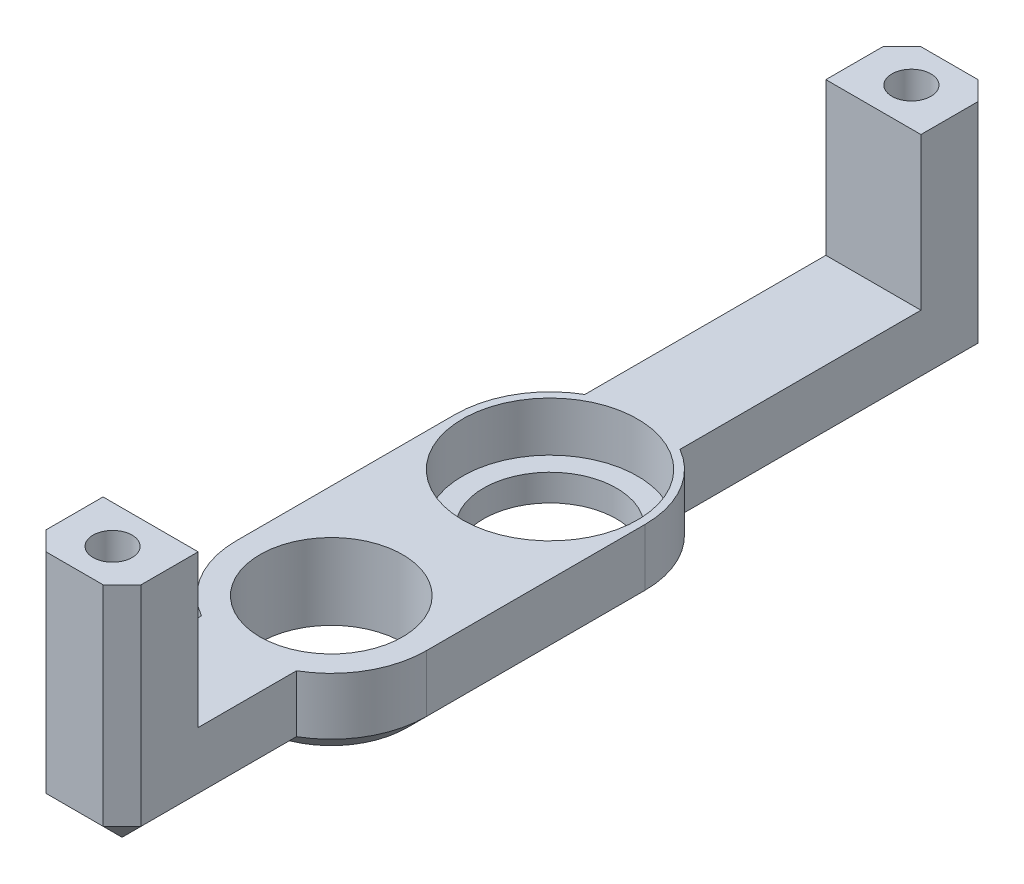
SolidWorks part; units mm, degrees
ref_plane "Plano frontal" through (0, 0, 0) normal (0, 0, 1) x (1, 0, 0)
ref_plane "Plano superior" through (0, 0, 0) normal (0, 1, 0) x (1, 0, 0)
ref_plane "Plano direito" through (0, 0, 0) normal (1, 0, 0) x (0, 0, -1)
sketch "Esboço2" plane through (0, 0, 0) normal (0, 1, 0) x (1, 0, 0)
  line L0 (0, 0) -> (0, 46)
  line L1 (0, 46) -> (10, 46)
  line L2 (10, 46) -> (10, 0)
  line L3 (10, 0) -> (0, 0)
  dimension "D1" = 46
  dimension "D2" = 10
extrude "Ressalto-extrusão1" add sketch "Esboço2" along normal blind 4
sketch "Esboço3" plane through (0, 4, 0) normal (0, 1, 0) x (1, 0, 0)
  line L0 (5, 46) -> (5, 25) construction
  line L1 (10, 46) -> (0, 46) construction
  line L2 (5, 25) -> (5, 13.5) construction
  circle A0 centre (5, 25) radius 4.6
  dimension "D3" = 9.2
  dimension "D1" = 21
  dimension "D2" = 11.5
sketch "Esboço6" plane through (0, 4, 0) normal (0, 1, 0) x (1, 0, 0)
  line L0 (2.5, 46) -> (7.5, 46) construction
  line L1 (10, 46) -> (0, 46) construction
  line L2 (2.5, 46) -> (2.5, 29.3301)
  line L3 (7.5, 46) -> (7.5, 29.3301)
  line L4 (2.5, 46) -> (0, 46)
  line L5 (0, 46) -> (0, 25)
  line L6 (0, 46) -> (0, 0) construction
  line L7 (7.5, 46) -> (10, 46)
  line L8 (10, 46) -> (10, 25)
  line L9 (10, 0) -> (10, 46) construction
  arc A0 (10, 25) -> (7.5, 29.3301) centre (5, 25) ccw
  arc A1 (2.5, 29.3301) -> (0, 25) centre (5, 25) ccw
  point P9 (5, 46)
  dimension "D2" = 5
extrude "Corte-extrusão1" cut sketch "Esboço6" against normal through all
hole_wizard "Furo de diâmetro Ø7.5 (7.5)1" positions "3DSketch2" profile "Esboço8" hole size "Ø7.5" standard "ISO"
sketch3d "3DSketch2"
  point P0 (5, 4, -13.5)
sketch "Esboço8" plane through (5, 4, -13.5) normal (1, 0, 0) x (0, 0, 1)
  line L0 (0, 0) -> (0, 4)
  line L1 (0, 4) -> (3.75, 4)
  line L2 (3.75, 4) -> (3.75, 0)
  line L5 (3.75, 0) -> (0, 0)
  line L11 (0, -6.35) -> (0, 107.95) construction
  dimension "Thru Hole Dia." = 7.5
  dimension "Thru Hole Depth" = 4
sketch "Esboço9" plane through (0, 4, 0) normal (0, 1, 0) x (1, 0, 0)
  line L0 (0, 13.5) -> (0, 0)
  line L1 (0, 25) -> (0, 0) construction
  line L2 (0, 0) -> (2.5, 0)
  line L3 (2.5, 0) -> (2.5, 9.1699)
  line L4 (7.5, 0) -> (7.5, 9.1699)
  line L5 (7.5, 0) -> (10, 0)
  line L6 (10, 0) -> (10, 25) construction
  line L7 (10, 0) -> (10, 13.5)
  line L9 (0, 0) -> (10, 0) construction
  arc A0 (0, 13.5) -> (2.5, 9.1699) centre (5, 13.5) ccw
  arc A1 (7.5, 9.1699) -> (10, 13.5) centre (5, 13.5) ccw
  dimension "D1" = 5
extrude "Corte-extrusão2" cut sketch "Esboço9" against normal blind 4
sketch "Esboço10" plane through (0, 4, 0) normal (0, 1, 0) x (1, 0, 0)
  line L0 (7.5, 46) -> (7.5, 29.3301) construction
  line L1 (2.5, 46) -> (7.5, 46)
  line L2 (2.5, 46) -> (2.5, 42)
  line L3 (2.5, 42) -> (7.5, 42)
  line L4 (7.5, 46) -> (7.5, 42)
  line L5 (7.5, 9.1699) -> (7.5, 0) construction
  line L6 (2.5, 0) -> (7.5, 0)
  line L7 (2.5, 0) -> (2.5, 4)
  line L8 (2.5, 4) -> (7.5, 4)
  line L9 (7.5, 0) -> (7.5, 4)
  dimension "D1" = 4
  dimension "D2" = 4
extrude "Ressalto-extrusão2" add sketch "Esboço10" along normal blind 8
chamfer "Chanfro1" distance 1 angle 45 16 edges at (2.5, 0, -4.5849) (5, 0, 0) (7.5, 0, -4.5849) (9.3301, 0, -11) (10, 0, -19.25) (9.3301, 0, -27.5) (7.5, 0, -37.6651) (5, 0, -46) (2.5, 0, -37.6651) (0.6699, 0, -27.5) (0, 0, -19.25) (0.6699, 0, -11) (2.5, 6, 0) (7.5, 6, 0) (7.5, 6, -46) (2.5, 6, -46)
sketch "Esboço11" plane through (0, 12, 0) normal (0, 1, 0) x (1, 0, 0)
  line L0 (5, 46) -> (5, 44) construction
  line L1 (6.5, 46) -> (3.5, 46) construction
  line L2 (5, 46) -> (5, 25) construction
  line L3 (5, 0) -> (5, 2) construction
  line L4 (3.5, 0) -> (6.5, 0) construction
  dimension "D1" = 2
  dimension "D2" = 2
hole_wizard "Broca de rosquear para tarraxa de M2.51" positions "3DSketch3" profile "Esboço12" hole size "M2.5" standard "ISO"
sketch3d "3DSketch3"
  point P0 (5, 12, -2)
  point P3 (5, 12, -44)
sketch "Esboço12" plane through (5, 12, -2) normal (1, 0, 0) x (0, 0, 1)
  line L0 (0, 0) -> (0, 4.6159)
  line L1 (0, 4.6159) -> (1.025, 4)
  line L2 (1.025, 4) -> (1.025, 0)
  line L5 (1.025, 0) -> (0, 0)
  line L10 (0, 4.6159) -> (-1.025, 4) construction
  line L11 (0, -6.35) -> (0, 107.95) construction
  dimension "Hole Dia." = 2.05
  dimension "Hole Depth" = 4
  dimension "Drill Angle" = 118
extrude "Corte-extrusão3" cut sketch "Esboço3" against normal blind 2.6
hole_wizard "Furo de diâmetro Ø7.0 (7)1" positions "3DSketch4" profile "Esboço13" hole size "Ø7.0" standard "ISO"
sketch3d "3DSketch4"
  point P0 (5, 4, -25)
sketch "Esboço13" plane through (5, 4, -25) normal (1, 0, 0) x (0, 0, 1)
  line L0 (0, 0) -> (0, 4)
  line L1 (0, 4) -> (3.5, 4)
  line L2 (3.5, 4) -> (3.5, 0)
  line L5 (3.5, 0) -> (0, 0)
  line L11 (0, -6.35) -> (0, 107.95) construction
  dimension "Thru Hole Dia." = 7
  dimension "Thru Hole Depth" = 4
